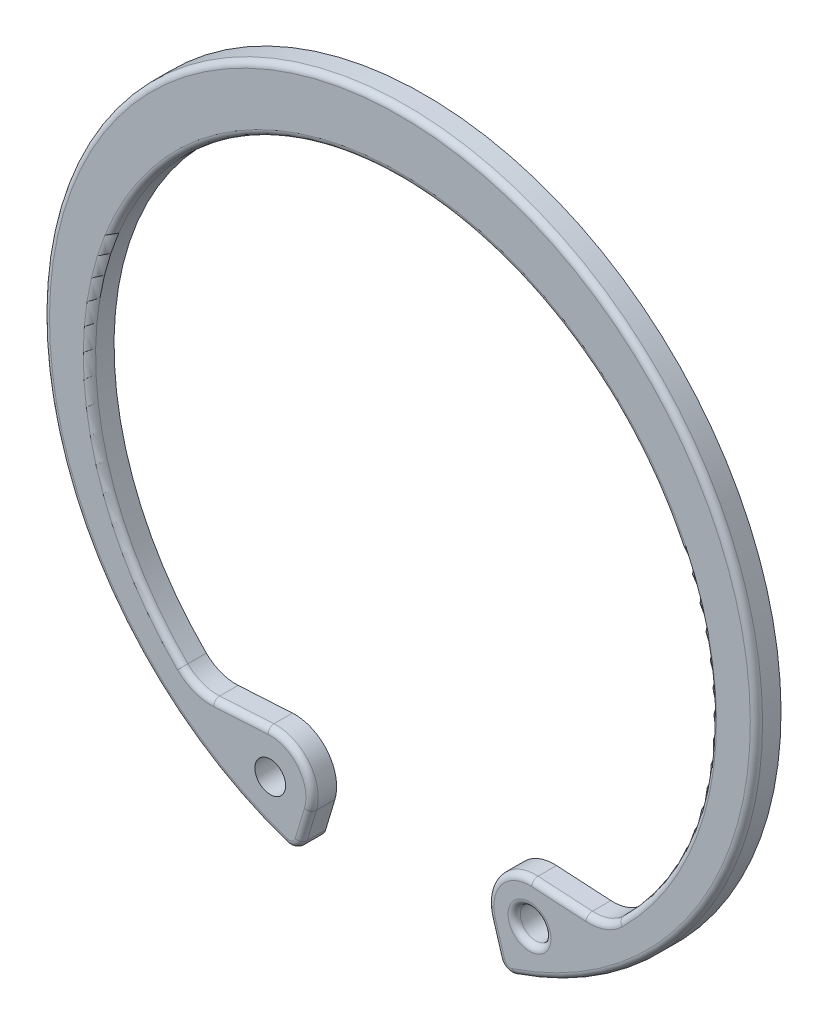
SolidWorks part; units mm, degrees
ref_plane "Face" through (0, 0, 0) normal (0, 0, 1) x (1, 0, 0)
ref_plane "Dessus" through (0, 0, 0) normal (0, 1, 0) x (1, 0, 0)
ref_plane "Droite" through (0, 0, 0) normal (1, 0, 0) x (0, 0, -1)
sketch "Esquisse1" plane through (0, 0, 0) normal (0, 0, 1) x (1, 0, 0)
  line L0 (0, 24) -> (0, 29) construction
  line L1 (7.2869, -24.3044) -> (8.3284, -27.7784)
  line L2 (9.1433, -20.2297) -> (11.944, -26.4262) construction
  line L3 (15.1588, -20.1892) -> (10.74, -19.9336)
  line L4 (-15.1588, -20.1892) -> (-10.74, -19.9336)
  line L5 (-7.2869, -24.3044) -> (-8.3284, -27.7784)
  line L6 (8.8834, -24.4068) -> (10.1238, -27.8149) construction
  line L7 (-8.8834, -24.4068) -> (-10.1238, -27.8149) construction
  arc A0 (8.3284, -27.7784) -> (-8.3284, -27.7784) centre (0, 0) ccw
  arc A1 (17.7445, -19.2137) -> (-17.7445, -19.2137) centre (0, -1.25) ccw
  arc A2 (10.74, -19.9336) -> (7.2869, -24.3044) centre (10.5436, -23.3279) ccw
  arc A3 (15.1588, -20.1892) -> (17.7445, -19.2137) centre (15.3551, -16.7948) ccw
  circle A4 centre (10.5436, -23.3279) radius 1.25
  arc A5 (-15.1588, -20.1892) -> (-17.7445, -19.2137) centre (-15.3551, -16.7948) cw
  circle A6 centre (-10.5436, -23.3279) radius 1.25
  arc A7 (-10.74, -19.9336) -> (-7.2869, -24.3044) centre (-10.5436, -23.3279) cw
  arc A8 (10.1238, -27.8149) -> (-10.1238, -27.8149) centre (0, 0) ccw construction
  circle A9 centre (0, 0) radius 27.5 construction
  dimension "dgorge" = 58
  dimension "D3" = 1.25
  dimension "dtrou" = 2.5
  dimension "dext" = 59.2
  dimension "dn" = 55
  dimension "b" = 5
  dimension "a" = 6.8
  dimension "D5" = 70
  dimension "D7" = 33.379
  dimension "D9" = 40
extrude "Base-Extrusion" add sketch "Esquisse1" along normal blind 2
fillet "Congé1" radius 1 2 edges at (8.3284, -27.7784, 1) (-8.3284, -27.7784, 1)
fillet "Congé2" radius 0.5 13 edges at (8.5355, -27.4049, 2) (7.6615, -25.5539, 2) (7.8758, -21.2202, 2) (12.9494, -20.0614, 2) (16.5552, -19.976, 2) (0, 24, 2) (-16.5552, -19.976, 2) (-12.9494, -20.0614, 2) (-7.8758, -21.2202, 2) (-7.6615, -25.5539, 2) (-8.5355, -27.4049, 2) (11.7936, -23.3279, 2) (0, 29, 2)
equation "\"D3@Esquisse1\" = \"b@Esquisse1\"/4"
equation "\"D7@Esquisse1\" = 360-(360-\"D9@Esquisse1\")*\"dext@Esquisse1\"/\"dgorge@Esquisse1\""
